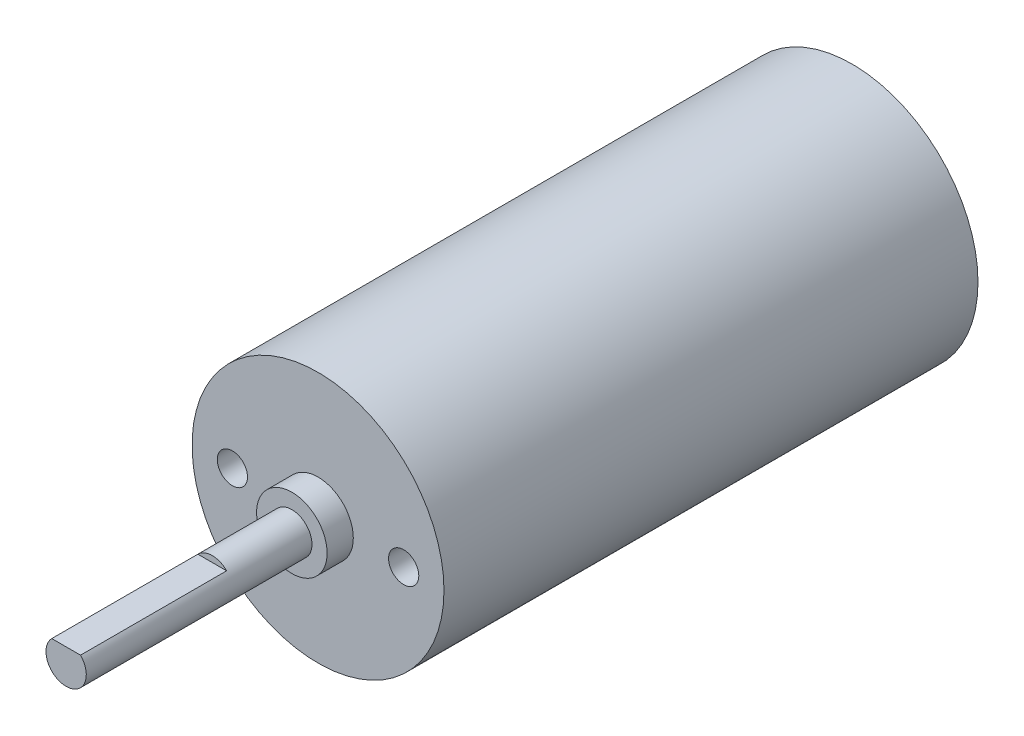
SolidWorks part; units mm, degrees
ref_plane "Front" through (0, 0, 0) normal (0, 0, 1) x (1, 0, 0)
ref_plane "Top" through (0, 0, 0) normal (0, 1, 0) x (1, 0, 0)
ref_plane "Right" through (0, 0, 0) normal (1, 0, 0) x (0, 0, -1)
sketch "Sketch1" plane through (0, 0, 0) normal (0, 0, 1) x (1, 0, 0)
  circle A0 centre (0, 0) radius 12.5
  dimension "body_diameter" = 25
extrude "body" add sketch "Sketch1" against normal blind 53
sketch "Sketch2" plane through (0, 0, 0) normal (0, 0, 1) x (1, 0, 0)
  circle A0 centre (0, 0) radius 2
  dimension "shaft_diameter" = 4
extrude "shaft" add sketch "Sketch2" along normal blind 25
sketch "Sketch3" plane through (0, 0, 0) normal (1, 0, 0) x (0, 0, -1)
  line L0 (-25, 1.4) -> (-10.5, 1.4)
  line L1 (0, 2) -> (-25, 2) construction
  line L2 (-25, 2) -> (-25, -2) construction
  line L3 (-10.5, 1.4) -> (-10.5, 2)
  line L4 (0, 2) -> (-25, 2) construction
  dimension "D1" = 14.5
  dimension "D3" = 0.6
extrude "shaft-flat" cut sketch "Sketch3" against normal through all and the other way through all
sketch "Sketch6" plane through (0, 0, 0) normal (0, 0, 1) x (1, 0, 0)
  circle A0 centre (0, 0) radius 2
  circle A1 centre (0, 0) radius 3.5
  circle A2 centre (0, 0) radius 2 construction
  dimension "D1" = 7
extrude "bushing" add sketch "Sketch6" along normal blind 2.6
hole_wizard "tapped mounting hole" positions "Sketch5" profile "Sketch4" tap size "M3x0.5" standard "ANSI Metric"
sketch "Sketch5" plane through (0, 0, 0) normal (0, 0, 1) x (1, 0, 0)
  point P0 (8.5, 0)
  dimension "bolt_circle_radius" = 8.5
sketch "Sketch4" plane through (8.5, 0, 0) normal (1, 0, 0) x (0, -1, 0)
  line L0 (0, 0) -> (0, 8.2511)
  line L1 (0, 8.2511) -> (1.25, 7.5)
  line L2 (1.25, 7.5) -> (1.25, 6)
  line L3 (1.25, 6) -> (1.5, 6)
  line L4 (1.5, 6) -> (1.5, 0)
  line L5 (1.5, 0) -> (0, 0)
  line L10 (0, 8.2511) -> (-1.25, 7.5) construction
  line L11 (0, -6.35) -> (0, 107.95) construction
  dimension "Tap Drill Dia." = 2.5
  dimension "Tap Drill Depth" = 7.5
  dimension "Thread Dia." = 3
  dimension "Thread Depth" = 6
  dimension "Drill Angle" = 118
pattern_circular "mounting hole pattern" count 2 over 360 about axis through (0, 0, 0) along (0, 0, 1) of "tapped mounting hole"
